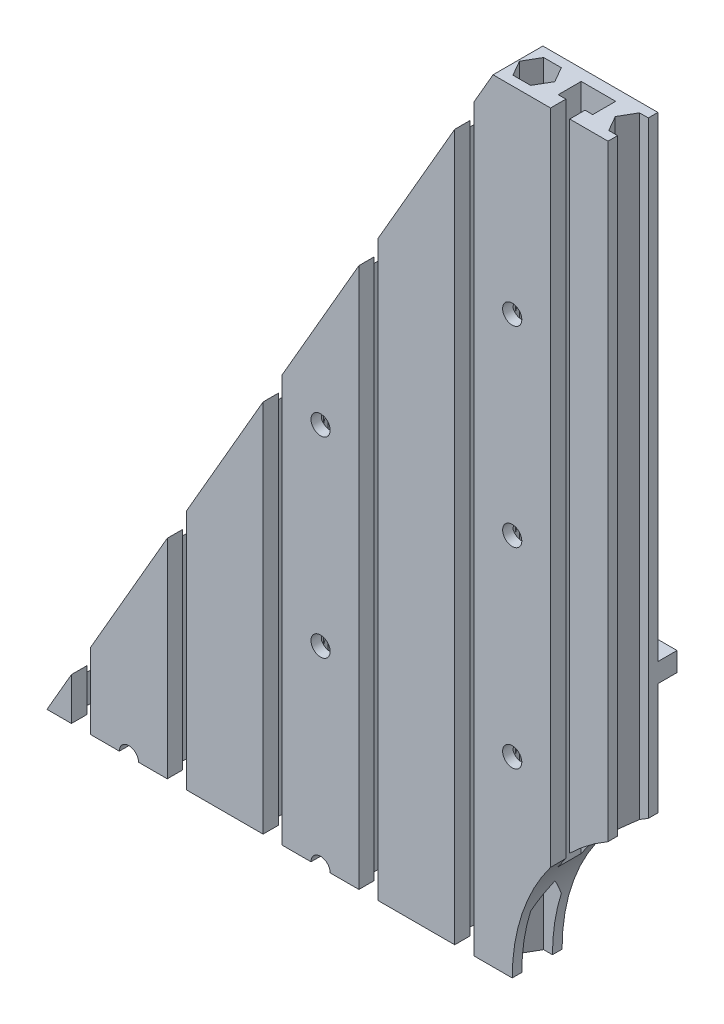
SolidWorks part; units mm, degrees
ref_plane "Plan de face" through (0, 0, 0) normal (0, 0, 1) x (1, 0, 0)
ref_plane "Plan de dessus" through (0, 0, 0) normal (0, 1, 0) x (1, 0, 0)
ref_plane "Plan de droite" through (0, 0, 0) normal (1, 0, 0) x (0, 0, -1)
sketch "Esquisse1" plane through (0, 0, 0) normal (0, 0, 1) x (1, 0, 0)
  line L6 (35.7636, 358.7862) -> (-423.8647, -437.3133) construction
  line L7 (-755.4678, -148.4209) -> (879.7592, -148.4209) construction
  line L8 (-46.1325, 376.7457) -> (415.4529, -422.7436) construction
  line L9 (257.0726, -148.4209) -> (-245.0999, 141.5085) construction
  line L10 (-257.0726, -148.4209) -> (263.2247, 151.9729) construction
  line L11 (-55, 201.5791) -> (55, 201.5791)
  line L12 (-147.0726, -148.4209) -> (147.0726, -148.4209)
  line L13 (147.0726, -148.4209) -> (202.0726, -53.1581)
  line L14 (202.0726, -53.1581) -> (55, 201.5791)
  line L15 (-147.0726, -148.4209) -> (-202.0726, -53.1581)
  line L16 (-202.0726, -53.1581) -> (-55, 201.5791)
  dimension "D1" = 60
  dimension "D2" = 60
  dimension "D3" = 110
  dimension "D4" = 350
  dimension "D5" = 60
  dimension "D6" = 60
  dimension "D7" = 110
  dimension "D8" = 110
extrude "Boss.-Extru.2" add sketch "Esquisse1" along normal blind 13
sketch "Esquisse3" plane through (0, 201.5791, 0) normal (0, 1, 0) x (1, 0, 0)
  line L0 (-12.5, 6.793) -> (-12.5, -19.2478) construction
  line L1 (-8, -3) -> (-17, -3)
  line L2 (-17, -3) -> (-17, -9)
  line L3 (-17, -9) -> (-15, -9)
  line L4 (-15, -9) -> (-15, -13)
  line L5 (55, -13) -> (-55, -13) construction
  line L6 (-10, -9) -> (-10, -13)
  line L7 (-8, -9) -> (-10, -9)
  line L8 (-8, -3) -> (-8, -9)
  line L9 (-15, -13) -> (-10, -13)
  point P2 (-12.5, -13)
  point P14 (-12.5, -3)
  dimension "D1" = 12.5
  dimension "D2" = 9
  dimension "D3" = 5
  dimension "D4" = 6
  dimension "D5" = 4
extrude "Enlèv. mat.-Extru.1" cut sketch "Esquisse3" against normal up to next
pattern_linear "Répétition linéaire1" count 8 spacing 25 along (1, 0, 0) of "Enlèv. mat.-Extru.1"
pattern_linear "Répétition linéaire2" count 7 spacing 25 along (-1, 0, 0) of "Enlèv. mat.-Extru.1"
sketch "3parties" plane through (0, 0, 0) normal (0, 0, 1) x (1, 0, 0)
  line L0 (-25, 201.5791) -> (-25, 43.3013)
  line L1 (-55, 201.5791) -> (55, 201.5791) construction
  line L2 (-50, 0) -> (-171.3817, 0)
  line L3 (-165, 11.0535) -> (-202.0726, -53.1581) construction
  line L4 (50, 0) -> (171.3817, 0)
  line L5 (202.0726, -53.1581) -> (165, 11.0535) construction
  line L6 (0, -50) -> (0, -148.4209)
  line L7 (-10, -148.4209) -> (10, -148.4209) construction
  circle A0 centre (0, 0) radius 50
  dimension "D1" = 100
  dimension "D2" = 10
sketch "certcleRotules" plane through (0, 0, 13) normal (0, 0, 1) x (1, 0, 0)
  circle A0 centre (0, 0) radius 157.5
  dimension "D1" = 315
sketch "Esquisse6" plane through (0, 0, 0) normal (0, 1, 0) x (1, 0, 0)
  line L0 (-157.5, -13) -> (157.5, -13) construction
  line L1 (0, 0) -> (-4.5, 0)
  line L2 (0, 0) -> (0, -13)
  line L3 (-2.5, -9) -> (-4.5, -9)
  line L4 (-4.5, 0) -> (-4.5, -9)
  line L7 (0, -13) -> (-2.5, -13)
  line L8 (-2.5, -9) -> (-2.5, -13)
  dimension "D1" = 4.5
  dimension "D2" = 2.5
  dimension "D3" = 4
revolve "Enlèvement de matière-Révolution1" cut sketch "Esquisse6" angle 360 about L2
pattern_linear "Répétition linéaire3" count 4 spacing 50 along (0, 1, 0) count 4 spacing 50 along (1, 0, 0) of "Enlèvement de matière-Révolution1"
pattern_linear "Répétition linéaire5" count 3 spacing 50 along (0, -1, 0) count 4 spacing 50 along (1, 0, 0) of "Enlèvement de matière-Révolution1"
pattern_linear "Répétition linéaire6" count 4 spacing 50 along (0, 1, 0) count 4 spacing 50 along (-1, 0, 0) of "Enlèvement de matière-Révolution1"
pattern_linear "Répétition linéaire7" count 3 spacing 50 along (0, -1, 0) count 4 spacing 50 along (-1, 0, 0) of "Enlèvement de matière-Révolution1"
sketch "Esquisse8" plane through (0, 0, 0) normal (0, 0, -1) x (-1, 0, 0)
  circle A0 centre (0, 100) radius 4.5 construction
  circle A1 centre (0, 100) radius 4.5
extrude "bouchonBarreauHaut" add sketch "Esquisse8" against normal blind 13
sketch "Esquisse7" plane through (0, 0, 0) normal (0, 0, -1) x (-1, 0, 0)
  line L1 (-6.5, 105.15) -> (6.5, 105.15)
  line L2 (-6.5, 105.15) -> (-6.5, 80.15)
  line L3 (-6.5, 80.15) -> (6.5, 80.15)
  line L4 (6.5, 105.15) -> (6.5, 80.15)
  line L5 (0, 9.9) -> (0, -9.9) construction
  dimension "D1" = 25
  dimension "D2" = 80.15
  dimension "D3" = 13
  dimension "D4" = 6.5
extrude "Boss.-Extru.4" add sketch "Esquisse7" along normal blind 5
sketch "Esquisse9" plane through (0, 0, 0) normal (1, 0, 0) x (0, 0, -1)
  line L0 (5, 80.15) -> (0, 80.15) construction
  line L1 (5, 80.15) -> (5, 105.15) construction
  line L3 (5, 85.15) -> (5, 82.5)
  line L4 (5, 82.5) -> (-3, 82.5)
  line L6 (-3, -148.4209) -> (-3, 201.5791) construction
  line L7 (-13, 157.5) -> (-13, -157.5) construction
  line L8 (-3, 79.15) -> (-13, 79.15)
  line L9 (-3, 79.15) -> (-3, 82.5)
  line L10 (5, 85.15) -> (-13, 85.15)
  line L11 (-13, 79.15) -> (-13, 85.15)
  dimension "D1" = 5
  dimension "D2" = 2.65
  dimension "D3" = 6
revolve "Enlèvement de matière-Révolution2" cut sketch "Esquisse9" angle 360 about L10
pattern_linear "Répétition linéaire8" count 2 spacing 15 along (0, 1, 0) of "Enlèvement de matière-Révolution2"
pattern_circular "Répétition circulaire1" count 3 every 120 about axis through (0, 0, 0) along (0, 0, 1) of "Boss.-Extru.4", "Enlèvement de matière-Révolution2", "Répétition linéaire8"
sketch "Esquisse10" plane through (0, 0, 0) normal (1, 0, 0) x (0, 0, -1)
  line L0 (0, 201.5791) -> (0, -53.1581) construction
  line L1 (0, 77.5) -> (5, 77.5)
  line L2 (0, 77.5) -> (0, 72.5)
  line L3 (0, 72.5) -> (5, 72.5)
  line L4 (5, 77.5) -> (5, 72.5)
  line L5 (0, 50) -> (0, -50) construction
  line L6 (0, -72.5) -> (5, -72.5)
  line L7 (0, -72.5) -> (0, -77.5)
  line L8 (0, -77.5) -> (5, -77.5)
  line L9 (5, -72.5) -> (5, -77.5)
  line L10 (5, 80.15) -> (5, 105.15) construction
  line L11 (-9, 50) -> (0, 50) construction
  line L13 (-9, -100) -> (0, -100) construction
  point P16 (2.5, 72.5)
  point P19 (2.5, -72.5)
  dimension "D1" = 22.5
  dimension "D2" = 5
  dimension "D3" = 22.5
  dimension "D4" = 5
extrude "Boss.-Extru.6" add sketch "Esquisse10" along normal mid plane 250
chamfer "Chanfrein1" distance 5 angle 60 4 edges at (125, -75, -5) (-125, -75, -5) (-125, 75, -5) (125, 75, -5)
sketch "Esquisse11" plane through (0, 0, 13) normal (0, 0, 1) x (1, 0, 0)
  line L0 (-10, -148.4209) -> (-10, 201.5791) construction
  line L1 (-10, 23.5) -> (10, 23.5)
  line L2 (-10, 23.5) -> (-10, -23.5)
  line L3 (-10, -23.5) -> (10, -23.5)
  line L4 (10, 23.5) -> (10, -23.5)
  line L5 (10, -148.4209) -> (10, 201.5791) construction
  dimension "D1" = 47
  dimension "D2" = 23.5
extrude "Enlèv. mat.-Extru.2" cut sketch "Esquisse11" against normal blind 8.9
sketch "Esquisse13" plane through (-8, 0, 0) normal (-1, 0, 0) x (0, 0, 1)
  line L1 (4.1, -23.5) -> (11.1, -23.5)
  line L2 (4.1, -23.5) -> (4.1, -40)
  line L3 (4.1, -40) -> (6.1, -40)
  line L4 (11.1, -23.5) -> (11.1, -35)
  arc A0 (6.1, -40) -> (11.1, -35) centre (6.1, -35) ccw
  dimension "D2" = 5
  dimension "D1" = 16.5
  dimension "D3" = 7
extrude "Enlèv. mat.-Extru.3" cut sketch "Esquisse13" against normal up to surface (16 mm away)
sketch "Esquisse14" plane through (0, 0, 4.1) normal (0, 0, 1) x (1, 0, 0)
  line L0 (-8, 23.5) -> (-8, -40) construction
  line L1 (-3, -20) -> (3, -20)
  line L2 (-8, -25) -> (-8, -35)
  line L3 (-3, -40) -> (3, -40)
  line L4 (8, -25) -> (8, -35)
  line L5 (8, -40) -> (8, 23.5) construction
  line L6 (8, -40) -> (-8, -40) construction
  arc A0 (-8, -35) -> (-3, -40) centre (-3, -35) ccw
  arc A1 (3, -40) -> (8, -35) centre (3, -35) ccw
  arc A2 (3, -20) -> (8, -25) centre (3, -25) cw
  arc A3 (-3, -20) -> (-8, -25) centre (-3, -25) ccw
  point P16 (8, -20)
  point P19 (-8, -20)
  dimension "D3" = 5
  dimension "D1" = 20
extrude "Enlèv. mat.-Extru.4" cut sketch "Esquisse14" against normal up to next
mirror "Symétrie1" about plane through (0, 0, 0) normal (0, 1, 0) of "Enlèv. mat.-Extru.4", "Enlèv. mat.-Extru.3"
sketch "Esquisse15" plane through (0, 0, 0) normal (0, 0, -1) x (-1, 0, 0)
  circle A0 centre (-50, 0) radius 4.5 construction
  circle A1 centre (0, -50) radius 4.5 construction
  circle A2 centre (50, 0) radius 4.5 construction
  circle A3 centre (0, 50) radius 4.5 construction
  circle A4 centre (-50, 0) radius 4.5
  circle A5 centre (0, -50) radius 4.5
  circle A6 centre (50, 0) radius 4.5
  circle A7 centre (0, 50) radius 4.5
extrude "boucheTrousCEntre" add sketch "Esquisse15" against normal up to surface (13 mm away)
sketch "Esquisse16" plane through (0, -148.4209, 0) normal (0, -1, 0) x (1, 0, 0)
  line L0 (0, -9.9) -> (0, 9.9) construction
  line L1 (-2.3094, 2.5) -> (2.3094, 2.5)
  line L2 (2.3094, 2.5) -> (4.6188, 6.5)
  line L3 (4.6188, 6.5) -> (2.3094, 10.5)
  line L4 (2.3094, 10.5) -> (-2.3094, 10.5)
  line L5 (-2.3094, 10.5) -> (-4.6188, 6.5)
  line L6 (-4.6188, 6.5) -> (-2.3094, 2.5)
  line L8 (-10, 13) -> (10, 13) construction
  circle A0 centre (0, 6.5) radius 4 construction
  dimension "D1" = 6.5
  dimension "D2" = 8
extrude "Enlèv. mat.-Extru.5" cut sketch "Esquisse16" against normal through all
pattern_linear "Répétition linéaire9" count 8 spacing 25 along (1, 0, 0) of "Enlèv. mat.-Extru.5"
pattern_linear "Répétition linéaire10" count 8 spacing 25 along (-1, 0, 0) of "Enlèv. mat.-Extru.5"
sketch "Esquisse17" plane through (0, 0, 0) normal (0, 0, 1) x (1, 0, 0)
  line L0 (147.0726, -148.4209) -> (202.0726, -53.1581) construction
  line L1 (-147.0726, -148.4209) -> (147.0726, -148.4209) construction
  line L2 (-147.0726, -148.4209) -> (-202.0726, -53.1581) construction
  line L3 (-202.0726, -53.1581) -> (-55, 201.5791) construction
  line L4 (-50, 0) -> (-171.3817, 0) construction
  line L5 (50, 0) -> (171.3817, 0) construction
  line L6 (202.0726, -53.1581) -> (55, 201.5791) construction
  line L7 (147.0726, -148.4209) -> (202.0726, -53.1581)
  line L8 (-147.0726, -148.4209) -> (147.0726, -148.4209)
  line L9 (-147.0726, -148.4209) -> (-202.0726, -53.1581)
  line L10 (-202.0726, -53.1581) -> (-171.3817, 0)
  line L11 (-50, 0) -> (-171.3817, 0)
  line L12 (50, 0) -> (171.3817, 0)
  line L13 (202.0726, -53.1581) -> (171.3817, 0)
  circle A0 centre (0, 0) radius 50 construction
  arc A1 (50, 0) -> (-50, 0) centre (0, 0) ccw
extrude "Enlèv. mat.-Extru.6" cut sketch "Esquisse17" against normal through all both and the other way through all
sketch "Esquisse20" plane through (0, 0, 0) normal (0, -1, 0) x (1, 0, 0)
  line L0 (52.3094, 2.5) -> (54.6188, 6.5) construction
  line L1 (45.3812, 6.5) -> (47.6906, 2.5)
  line L2 (47.6906, 2.5) -> (52.3094, 2.5)
  line L3 (52.3094, 2.5) -> (54.6188, 6.5)
  line L4 (54.6188, 6.5) -> (52.3094, 10.5)
  line L5 (52.3094, 10.5) -> (47.6906, 10.5)
  line L6 (47.6906, 10.5) -> (45.3812, 6.5)
  line L7 (54.6188, 6.5) -> (52.3094, 10.5) construction
  line L9 (51.1547, 4.5) -> (52.3094, 6.5)
  line L10 (52.3094, 6.5) -> (51.1547, 8.5)
  line L11 (51.1547, 8.5) -> (48.8453, 8.5)
  line L12 (48.8453, 8.5) -> (47.6906, 6.5)
  line L13 (47.6906, 6.5) -> (48.8453, 4.5)
  line L14 (48.8453, 4.5) -> (51.1547, 4.5)
  circle A0 centre (50, 6.5) radius 4 construction
  circle A1 centre (50, 6.5) radius 2 construction
  dimension "D1" = 4
extrude "Boss.-Extru.7" [suppressed] add sketch "Esquisse20" along normal mid plane 20
pattern_linear "Répétition linéaire11" [suppressed] count 3 spacing 50 along (1, 0, 0)
mirror "Symétrie2" [suppressed] about plane through (0, 0, 0) normal (1, 0, 0)
sketch "Esquisse22" plane through (0, 0, 0) normal (0, 0, -1) x (-1, 0, 0)
  line L0 (25, 201.5791) -> (25, 43.3013) construction
  line L1 (25, 201.5791) -> (25, 43.3013)
  line L9 (154.5, 0) -> (171.3817, 0)
  line L10 (171.3817, 0) -> (55, 201.5791)
  line L11 (55, 201.5791) -> (-55, 201.5791)
  line L12 (-55, 201.5791) -> (-171.3817, 0)
  line L13 (-171.3817, 0) -> (-154.5, 0)
  line L14 (-145.5, 0) -> (-104.5, 0)
  line L15 (-95.5, 0) -> (-50, 0)
  line L16 (50, 0) -> (95.5, 0)
  line L17 (104.5, 0) -> (145.5, 0)
  line L20 (25, 201.5791) -> (-55, 201.5791)
  line L21 (-55, 201.5791) -> (-171.3817, 0)
  line L22 (-171.3817, 0) -> (-154.5, 0)
  line L23 (-145.5, 0) -> (-104.5, 0)
  line L24 (-95.5, 0) -> (-50, 0)
  arc A5 (-145.5, 0) -> (-154.5, 0) centre (-150, 0) ccw
  arc A6 (-95.5, 0) -> (-104.5, 0) centre (-100, 0) ccw
  arc A7 (50, 0) -> (-50, 0) centre (0, 0) ccw
  arc A8 (104.5, 0) -> (95.5, 0) centre (100, 0) ccw
  arc A9 (154.5, 0) -> (145.5, 0) centre (150, 0) ccw
  arc A10 (-145.5, 0) -> (-154.5, 0) centre (-150, 0) ccw
  arc A11 (-95.5, 0) -> (-104.5, 0) centre (-100, 0) ccw
  arc A12 (25, 43.3013) -> (-50, 0) centre (0, 0) ccw
  dimension "D1" = 0
extrude "Enlèv. mat.-Extru.9" cut sketch "Esquisse22" against normal through all both and the other way through all
